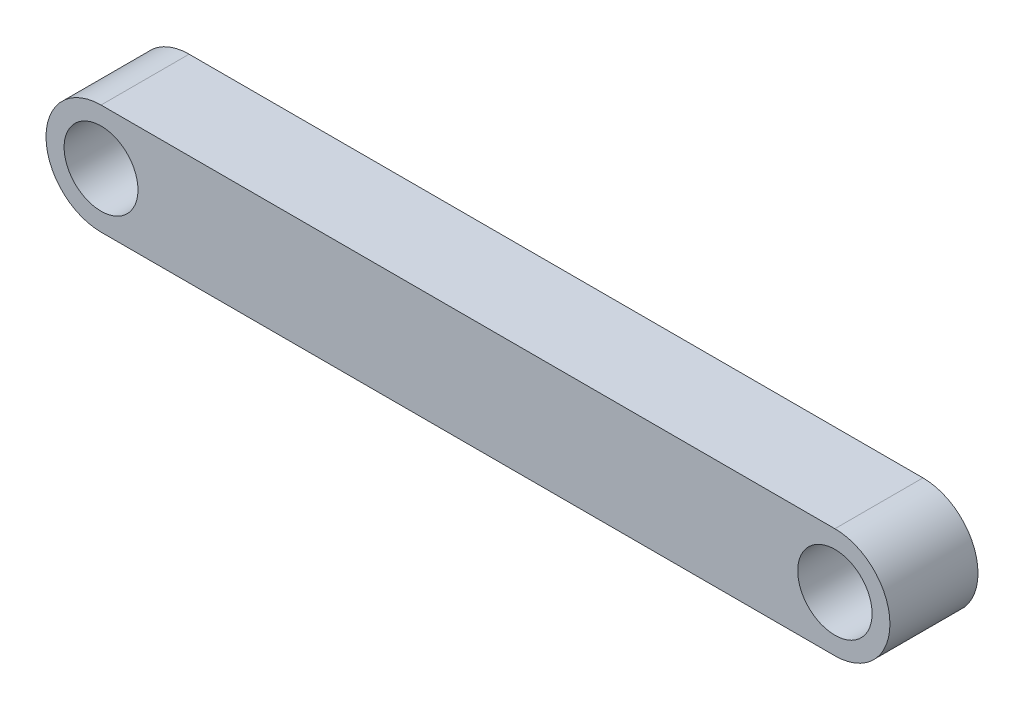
SolidWorks part; units mm, degrees
ref_plane "Front" through (0, 0, 0) normal (0, 0, 1) x (1, 0, 0)
ref_plane "Top" through (0, 0, 0) normal (0, 1, 0) x (1, 0, 0)
ref_plane "Right" through (0, 0, 0) normal (1, 0, 0) x (0, 0, -1)
sketch "Sketch1" plane through (0, 0, 0) normal (0, 0, 1) x (1, 0, 0)
  line L1 (0, 0) -> (127, 0)
  line L3 (0, 19.05) -> (127, 19.05)
  arc A0 (127, 19.05) -> (127, 0) centre (127, 9.525) cw
  arc A1 (0, 19.05) -> (0, 0) centre (0, 9.525) ccw
  circle A2 centre (127, 9.525) radius 6.4354
  circle A3 centre (0, 9.525) radius 6.3906
  dimension "D1" = 127
  dimension "D2" = 19.05
extrude "Extrude1" add sketch "Sketch1" along normal blind 15.24
sketch "Sketch2" plane through (0, 0, 0) normal (0, -1, 0) x (1, 0, 0)
  line L0 (63.5, 7.62) -> (63.5, 0)
  line L2 (0, 0) -> (127, 0) construction
  line L3 (63.5, 7.62) -> (0, 7.62)
  line L5 (0, 15.24) -> (0, 0) construction
